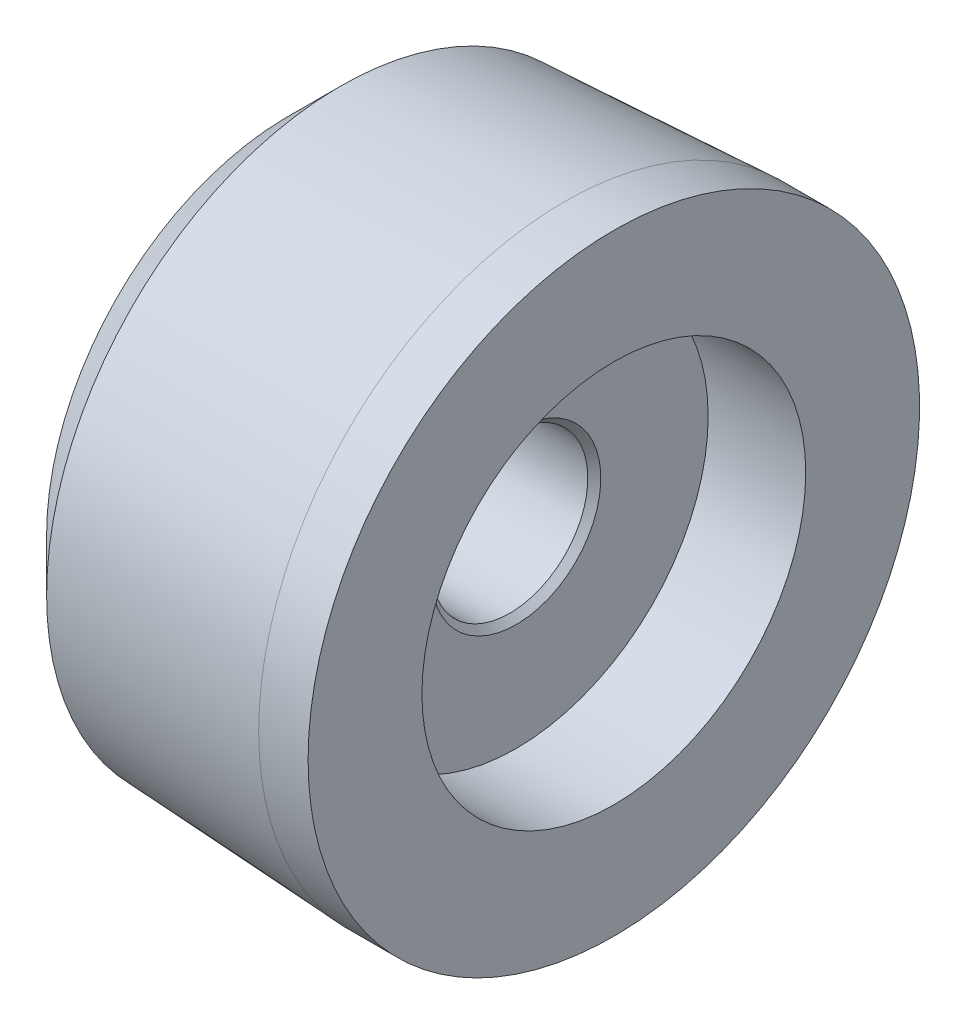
SolidWorks part; units mm, degrees
ref_plane "Plan de face" through (0, 0, 0) normal (0, 0, 1) x (1, 0, 0)
ref_plane "Plan de dessus" through (0, 0, 0) normal (0, 1, 0) x (1, 0, 0)
ref_plane "Plan de droite" through (0, 0, 0) normal (1, 0, 0) x (0, 0, -1)
ref_plane "Plan1" through (0, 0, 0) normal (0, 0, -1) x (-1, 0, 0)
sketch "Esquisse1" plane through (0, 0, 0) normal (0, 0, -1) x (-1, 0, 0)
  line L0 (-5, 6.4999) -> (-4.5001, 6)
  line L1 (-4.5001, 6) -> (4.5001, 6)
  line L2 (4.5001, 6) -> (5, 6.4999)
  line L3 (5, 6.4999) -> (5, 14.75)
  line L4 (5, 14.75) -> (12.5, 14.75)
  line L5 (12.5, 14.75) -> (12.5, 18.5986)
  line L6 (12.5, 18.5986) -> (8.5, 22.5986)
  line L7 (8.5, 22.5986) -> (-8.7, 23.5)
  line L8 (-8.7, 23.5) -> (-12.5, 23.5)
  line L9 (-12.5, 23.5) -> (-12.5, 14.75)
  line L10 (-12.5, 14.75) -> (-5, 14.75)
  line L11 (-5, 14.75) -> (-5, 6.4999)
  line L12 (-12.5, 0) -> (12.5, 0) construction
revolve "Révolution1" add sketch "Esquisse1" angle 360 about L12
